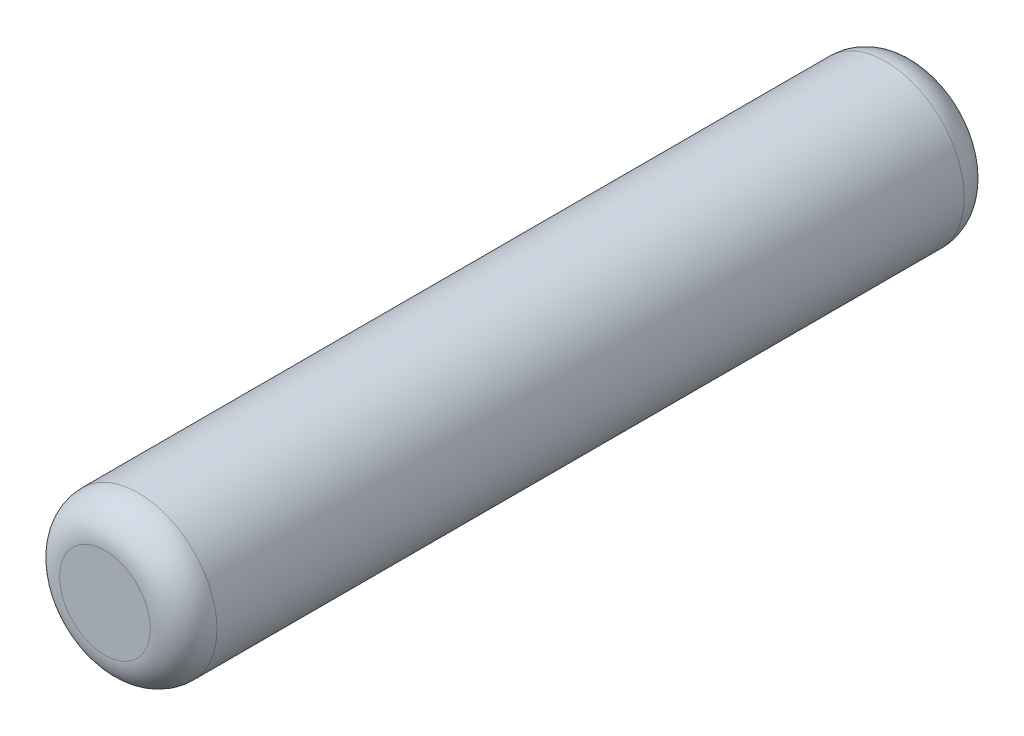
SolidWorks part; units mm, degrees
ref_plane "Спереди" through (0, 0, 0) normal (0, 0, 1) x (1, 0, 0)
ref_plane "Сверху" through (0, 0, 0) normal (0, 1, 0) x (1, 0, 0)
ref_plane "Справа" through (0, 0, 0) normal (1, 0, 0) x (0, 0, -1)
sketch "Эскиз1" plane through (0, 0, 0) normal (1, 0, 0) x (0, 0, -1)
  line L0 (-35.491, 0) -> (40.2088, 0) construction
  line L1 (-6.2103, 0) -> (6.2103, 0)
  line L2 (6.2103, 0) -> (6.2103, 0.6921)
  line L3 (5.7023, 1.2001) -> (-5.7023, 1.2001)
  line L4 (-6.2103, 0.6921) -> (-6.2103, 0)
  arc A0 (-5.7023, 1.2001) -> (-6.2103, 0.6921) centre (-5.7023, 0.6921) ccw
  arc A1 (6.2103, 0.6921) -> (5.7023, 1.2001) centre (5.7023, 0.6921) ccw
  dimension "D3" = 0.508
  dimension "D1" = 12.4206
  dimension "D2" = 2.4003
revolve "Повернуть1" add sketch "Эскиз1" angle 360 about L0
